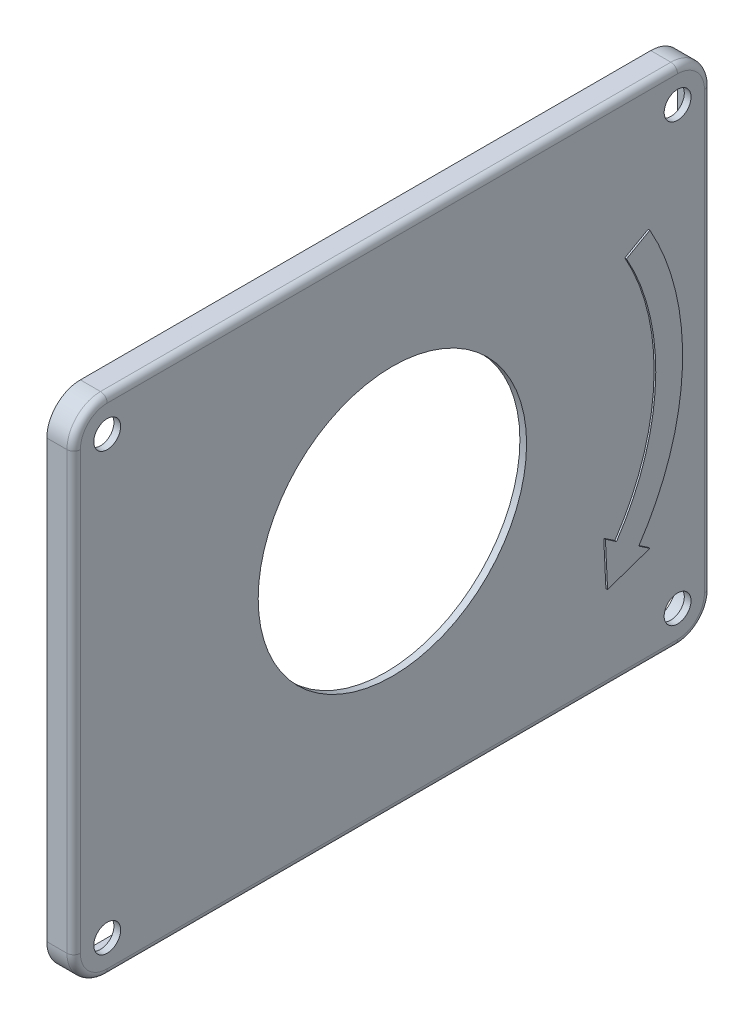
SolidWorks part; units mm, degrees
other "<Emergency Door Valve_Plate>-<Boss-Extrude2>"
ref_plane "Front Plane" through (0, 0, 0) normal (0, 0, 1) x (1, 0, 0)
ref_plane "Top Plane" through (0, 0, 0) normal (0, 1, 0) x (1, 0, 0)
ref_plane "Right Plane" through (0, 0, 0) normal (1, 0, 0) x (0, 0, -1)
mirrored part "Emergency Door Valve_Plate_Mirrored"
